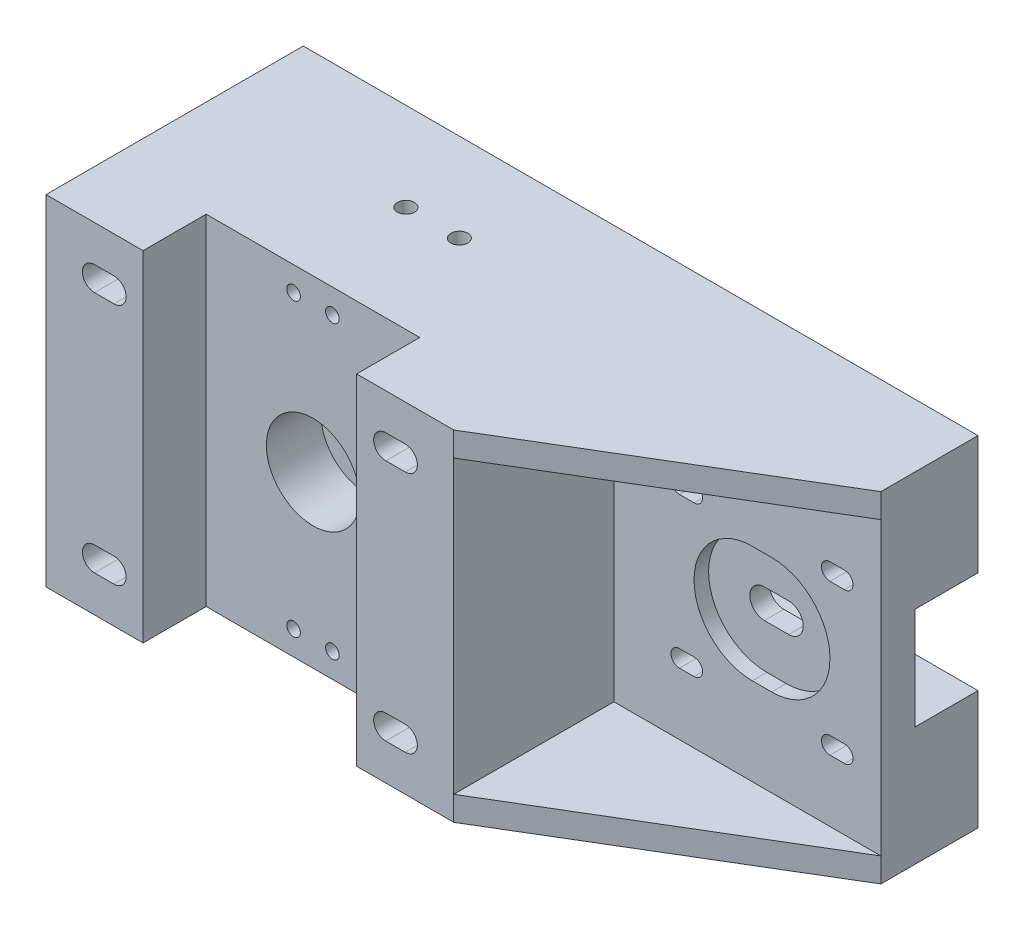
SolidWorks part; units mm, degrees
ref_plane "Спереди" through (0, 0, 0) normal (0, 0, 1) x (1, 0, 0)
ref_plane "Сверху" through (0, 0, 0) normal (0, 1, 0) x (1, 0, 0)
ref_plane "Справа" through (0, 0, 0) normal (1, 0, 0) x (0, 0, -1)
sketch "Эскиз1" plane through (0, 0, 0) normal (0, 1, 0) x (1, 0, 0)
  line L0 (0, 0) -> (0, 80) construction
  line L1 (-36.9154, 0) -> (36.9154, 0) construction
  line L2 (22, 0) -> (22, -13)
  line L3 (22, -13) -> (42, -13)
  line L4 (42, -13) -> (42, 40)
  line L5 (42, 40) -> (0, 40)
  line L6 (22, 0) -> (-22, 0)
  line L7 (-42, -13) -> (-42, 40)
  line L8 (-42, 40) -> (0, 40)
  line L9 (-22, -13) -> (-42, -13)
  line L10 (-22, 0) -> (-22, -13)
  dimension "D3" = 13
  dimension "D4" = 40
  dimension "D5" = 44
  dimension "D7" = 42
extrude "Бобышка-Вытянуть1" add sketch "Эскиз1" along normal blind 70
sketch "Эскиз2" plane through (0, 0, 0) normal (0, 0, 1) x (1, 0, 0)
  line L0 (0, 0) -> (0, 70) construction
  line L1 (22, 70) -> (-22, 70) construction
  line L2 (-22, 35) -> (0, 35) construction
  line L4 (-22, 70) -> (-22, 0) construction
  circle A0 centre (-4, 65) radius 1.4
  circle A1 centre (-4, 5) radius 1.4
  circle A2 centre (4, 5) radius 1.4
  circle A3 centre (4, 65) radius 1.4
  dimension "D1" = 5
  dimension "D2" = 4
  dimension "D3" = 2.8
extrude "Вырез-Вытянуть1" cut sketch "Эскиз2" against normal blind 5
sketch "Эскиз3" plane through (0, 0, 0) normal (0, 0, 1) x (1, 0, 0)
  line L0 (-22, 35) -> (22, 35) construction
  line L1 (-22, 70) -> (-22, 0) construction
  line L2 (22, 70) -> (22, 0) construction
  circle A0 centre (0, 35) radius 9.6
  dimension "D1" = 19.2
extrude "Вырез-Вытянуть2" cut sketch "Эскиз3" against normal blind 11.2
sketch "Эскиз4" plane through (0, 0, -40) normal (0, 0, -1) x (-1, 0, 0)
  line L0 (-42, 35) -> (42, 35) construction
  line L1 (-42, 70) -> (-42, 0) construction
  line L2 (42, 70) -> (42, 0) construction
  circle A0 centre (0, 35) radius 9.6
  dimension "D1" = 19.2
extrude "Вырез-Вытянуть3" cut sketch "Эскиз4" against normal blind 19
sketch "Эскиз5" plane through (42, 0, 0) normal (1, 0, 0) x (0, 0, -1)
  line L0 (-13, 35) -> (40, 35) construction
  line L1 (40, 70) -> (20, 70)
  line L2 (40, 70) -> (40, 0)
  line L3 (40, 0) -> (20, 0)
  line L4 (20, 70) -> (20, 0)
  line L5 (-13, 70) -> (-13, 0) construction
  line L6 (40, 70) -> (40, 0) construction
  line L7 (-13, 70) -> (40, 70) construction
  dimension "D2" = 20
extrude "Бобышка-Вытянуть2" add sketch "Эскиз5" along normal blind 55
sketch "Эскиз6" plane through (0, 0, -40) normal (0, 0, -1) x (-1, 0, 0)
  line L0 (0, 35) -> (-97, 35) construction
  line L1 (-97, 0) -> (-97, 70) construction
  line L2 (-97, 0) -> (-97, 70) construction
  line L3 (-97, 45.5) -> (10, 45.5)
  line L4 (-97, 45.5) -> (-97, 24.5)
  line L5 (-97, 24.5) -> (10, 24.5)
  line L6 (10, 45.5) -> (10, 24.5)
  circle A0 centre (0, 35) radius 9.6 construction
  dimension "D2" = 10
  dimension "D1" = 21
  dimension "D3" = 0
extrude "Вырез-Вытянуть4" cut sketch "Эскиз6" against normal blind 13
sketch "Эскиз7" plane through (0, 70, 0) normal (0, 1, 0) x (1, 0, 0)
  line L0 (42, -13) -> (97, 20)
  line L1 (97, 20) -> (42, 20)
  line L2 (42, 20) -> (42, -13)
extrude "Бобышка-Вытянуть3" add sketch "Эскиз7" against normal blind 5
sketch "Эскиз8" plane through (0, 0, 0) normal (0, -1, 0) x (1, 0, 0)
  line L0 (42, 13) -> (97, -20)
  line L1 (97, -20) -> (42, -20)
  line L2 (42, -20) -> (42, 13)
extrude "Бобышка-Вытянуть4" add sketch "Эскиз8" against normal blind 5
sketch "Эскиз9" plane through (0, 0, -40) normal (0, 0, -1) x (-1, 0, 0)
  line L0 (-89.5, 50.5) -> (-86.5, 50.5) construction
  line L1 (-89.5, 52.25) -> (-86.5, 52.25)
  line L2 (-89.5, 48.75) -> (-86.5, 48.75)
  line L3 (-58.5, 50.5) -> (-55.5, 50.5) construction
  line L4 (-58.5, 52.25) -> (-55.5, 52.25)
  line L5 (-58.5, 48.75) -> (-55.5, 48.75)
  line L6 (-89.5, 19.5) -> (-86.5, 19.5) construction
  line L7 (-89.5, 21.25) -> (-86.5, 21.25)
  line L8 (-89.5, 17.75) -> (-86.5, 17.75)
  line L9 (-58.5, 19.5) -> (-55.5, 19.5) construction
  line L10 (-58.5, 21.25) -> (-55.5, 21.25)
  line L11 (-58.5, 17.75) -> (-55.5, 17.75)
  arc A0 (-58.5, 21.25) -> (-58.5, 17.75) centre (-58.5, 19.5) ccw
  circle A1 centre (-57, 19.5) radius 2 construction
  circle A2 centre (-88, 19.5) radius 2 construction
  circle A3 centre (-88, 50.5) radius 2 construction
  circle A4 centre (-57, 50.5) radius 2 construction
  circle A6 centre (-57, 19.5) radius 2 construction
  circle A7 centre (-88, 19.5) radius 2 construction
  circle A8 centre (-88, 50.5) radius 2 construction
  circle A9 centre (-57, 50.5) radius 2 construction
  arc A14 (-89.5, 52.25) -> (-89.5, 48.75) centre (-89.5, 50.5) ccw
  arc A15 (-86.5, 48.75) -> (-86.5, 52.25) centre (-86.5, 50.5) ccw
  arc A16 (-58.5, 52.25) -> (-58.5, 48.75) centre (-58.5, 50.5) ccw
  arc A17 (-55.5, 48.75) -> (-55.5, 52.25) centre (-55.5, 50.5) ccw
  arc A18 (-89.5, 21.25) -> (-89.5, 17.75) centre (-89.5, 19.5) ccw
  arc A19 (-86.5, 17.75) -> (-86.5, 21.25) centre (-86.5, 19.5) ccw
  arc A20 (-55.5, 17.75) -> (-55.5, 21.25) centre (-55.5, 19.5) ccw
  point P10 (-88, 50.5)
  point P19 (-57, 50.5)
  point P26 (-88, 19.5)
  point P33 (-57, 19.5)
  dimension "D1" = 3.5
  dimension "D2" = 3
  dimension "D3" = 3.5
  dimension "D4" = 3
  dimension "D5" = 3.5
  dimension "D6" = 3
  dimension "D7" = 3
  dimension "D8" = 3.5
extrude "Вырез-Вытянуть5" cut sketch "Эскиз9" against normal blind 68
sketch "Эскиз10" plane through (0, 0, -21) normal (0, 0, -1) x (-1, 0, 0)
  circle A0 centre (0, 35) radius 3.25
  dimension "D1" = 6.5
extrude "Вырез-Вытянуть6" cut sketch "Эскиз10" against normal blind 68
sketch "Эскиз11" plane through (0, 0, -20) normal (0, 0, 1) x (1, 0, 0)
  line L0 (70.5, 35) -> (74.5, 35) construction
  line L1 (70.5, 47) -> (74.5, 47)
  line L2 (70.5, 23) -> (74.5, 23)
  circle A0 centre (72.5, 35) radius 11 construction
  circle A1 centre (72.5, 35) radius 11 construction
  arc A3 (70.5, 47) -> (70.5, 23) centre (70.5, 35) ccw
  arc A4 (74.5, 23) -> (74.5, 47) centre (74.5, 35) ccw
  point P5 (72.5, 35)
  dimension "D1" = 24
  dimension "D2" = 4
extrude "Вырез-Вытянуть7" cut sketch "Эскиз11" against normal blind 3
sketch "Эскиз12" plane through (0, 0, -23) normal (0, 0, 1) x (1, 0, 0)
  line L0 (72.5, 47) -> (72.5, 23) construction
  line L1 (74.5, 47) -> (70.5, 47) construction
  line L2 (70.5, 23) -> (74.5, 23) construction
  line L3 (70, 35) -> (75, 35) construction
  line L4 (70, 38) -> (75, 38)
  line L5 (70, 32) -> (75, 32)
  arc A1 (70, 38) -> (70, 32) centre (70, 35) ccw
  arc A2 (75, 32) -> (75, 38) centre (75, 35) ccw
  point P9 (72.5, 35)
  dimension "D1" = 6
  dimension "D2" = 5
extrude "Вырез-Вытянуть8" cut sketch "Эскиз12" against normal through all
sketch "Эскиз14" plane through (0, 0, -40) normal (0, 0, -1) x (-1, 0, 0)
  line L0 (-91.25, 50.5) -> (-84.75, 50.5) construction
  line L1 (-88, 52.25) -> (-88, 48.75) construction
  line L2 (-86.5, 52.25) -> (-89.5, 52.25) construction
  line L3 (-89.5, 48.75) -> (-86.5, 48.75) construction
  line L4 (-60.25, 50.5) -> (-53.75, 50.5) construction
  line L5 (-57, 52.25) -> (-57, 48.75) construction
  line L6 (-55.5, 52.25) -> (-58.5, 52.25) construction
  line L7 (-58.5, 48.75) -> (-55.5, 48.75) construction
  line L8 (-88, 21.25) -> (-88, 17.75) construction
  line L9 (-86.5, 21.25) -> (-89.5, 21.25) construction
  line L10 (-89.5, 17.75) -> (-86.5, 17.75) construction
  line L11 (-91.25, 19.5) -> (-84.75, 19.5) construction
  line L12 (-57, 21.25) -> (-57, 17.75) construction
  line L13 (-55.5, 21.25) -> (-58.5, 21.25) construction
  line L14 (-58.5, 17.75) -> (-55.5, 17.75) construction
  line L15 (-60.25, 19.5) -> (-53.75, 19.5) construction
  line L16 (-90, 50.5) -> (-86, 50.5) construction
  line L17 (-90, 53.5) -> (-86, 53.5)
  line L18 (-90, 47.5) -> (-86, 47.5)
  line L19 (-59, 50.5) -> (-55, 50.5) construction
  line L20 (-59, 53.5) -> (-55, 53.5)
  line L21 (-59, 47.5) -> (-55, 47.5)
  line L22 (-90, 19.5) -> (-86, 19.5) construction
  line L23 (-90, 22.5) -> (-86, 22.5)
  line L24 (-90, 16.5) -> (-86, 16.5)
  line L25 (-59, 19.5) -> (-55, 19.5) construction
  line L26 (-59, 22.5) -> (-55, 22.5)
  line L27 (-59, 16.5) -> (-55, 16.5)
  arc A0 (-89.5, 52.25) -> (-89.5, 48.75) centre (-89.5, 50.5) ccw construction
  arc A1 (-86.5, 48.75) -> (-86.5, 52.25) centre (-86.5, 50.5) ccw construction
  arc A2 (-58.5, 52.25) -> (-58.5, 48.75) centre (-58.5, 50.5) ccw construction
  arc A3 (-55.5, 48.75) -> (-55.5, 52.25) centre (-55.5, 50.5) ccw construction
  arc A4 (-89.5, 21.25) -> (-89.5, 17.75) centre (-89.5, 19.5) ccw construction
  arc A5 (-86.5, 17.75) -> (-86.5, 21.25) centre (-86.5, 19.5) ccw construction
  arc A6 (-58.5, 21.25) -> (-58.5, 17.75) centre (-58.5, 19.5) ccw construction
  arc A7 (-55.5, 17.75) -> (-55.5, 21.25) centre (-55.5, 19.5) ccw construction
  arc A8 (-90, 53.5) -> (-90, 47.5) centre (-90, 50.5) ccw
  arc A9 (-86, 47.5) -> (-86, 53.5) centre (-86, 50.5) ccw
  arc A10 (-59, 53.5) -> (-59, 47.5) centre (-59, 50.5) ccw
  arc A11 (-55, 47.5) -> (-55, 53.5) centre (-55, 50.5) ccw
  arc A12 (-90, 22.5) -> (-90, 16.5) centre (-90, 19.5) ccw
  arc A13 (-86, 16.5) -> (-86, 22.5) centre (-86, 19.5) ccw
  arc A14 (-59, 22.5) -> (-59, 16.5) centre (-59, 19.5) ccw
  arc A15 (-55, 16.5) -> (-55, 22.5) centre (-55, 19.5) ccw
  point P58 (-88, 50.5)
  point P63 (-57, 50.5)
  point P72 (-88, 19.5)
  point P77 (-57, 19.5)
  dimension "D1" = 6
  dimension "D2" = 6
  dimension "D3" = 6
  dimension "D4" = 6
  dimension "D5" = 4
  dimension "D6" = 4
  dimension "D7" = 4
  dimension "D8" = 4
extrude "Вырез-Вытянуть10" cut sketch "Эскиз14" against normal blind 5
sketch "Эскиз15" plane through (0, 0, -40) normal (0, 0, -1) x (-1, 0, 0)
  line L0 (42, 35) -> (-97, 35) construction
  line L1 (42, 70) -> (42, 0) construction
  line L2 (-97, 45.5) -> (-97, 24.5) construction
  line L3 (-97, 70) -> (42, 70) construction
  line L4 (-92, 65) -> (37, 65) construction
  line L5 (-92, 65) -> (-92, 5) construction
  line L6 (-92, 5) -> (37, 5) construction
  line L7 (37, 65) -> (37, 5) construction
  line L8 (-97, 45.5) -> (-97, 70) construction
  line L9 (-13, 65) -> (-13, 5) construction
  circle A0 centre (-92, 65) radius 1.4
  circle A1 centre (37, 65) radius 1.4
  circle A2 centre (37, 5) radius 1.4
  circle A3 centre (-92, 5) radius 1.4
  circle A4 centre (-13, 65) radius 1.4
  circle A6 centre (-13, 5) radius 1.4
  dimension "D4" = 2.8
  dimension "D1" = 5
  dimension "D2" = 5
  dimension "D3" = 5
  dimension "D5" = 50
extrude "Вырез-Вытянуть11" cut sketch "Эскиз15" against normal blind 5
ref_plane "Плоскость1" through (0, 35, 0) normal (0, -1, 0) x (-1, 0, 0)
sketch "Эскиз16" plane through (0, 0, 13) normal (0, 0, 1) x (1, 0, 0)
  line L0 (-42, 35) -> (42, 35) construction
  line L1 (-42, 70) -> (-42, 0) construction
  line L2 (42, 65) -> (42, 5) construction
  line L4 (-30, 10) -> (30, 10) construction
  line L5 (-30, 10) -> (-30, 60) construction
  line L6 (-30, 60) -> (30, 60) construction
  line L7 (30, 10) -> (30, 60) construction
  line L8 (-30, 10) -> (30, 60) construction
  line L9 (-30, 60) -> (30, 10) construction
  circle A0 centre (-30, 60) radius 2.4
  circle A1 centre (30, 60) radius 2.4
  circle A2 centre (30, 10) radius 2.4
  circle A3 centre (-30, 10) radius 2.4
  point P6 (0, 35)
  dimension "D1" = 4.8
  dimension "D2" = 50
  dimension "D3" = 60
extrude "Вырез-Вытянуть12" cut sketch "Эскиз16" against normal through all
sketch "Эскиз17" plane through (0, 70, 0) normal (0, 1, 0) x (1, 0, 0)
  circle A0 centre (8.35, 21.8) radius 1.75 construction
  circle A1 centre (-2.65, 21.8) radius 1.75 construction
  circle A2 centre (8.35, 21.8) radius 1.75
  circle A3 centre (-2.65, 21.8) radius 1.75
extrude "Вырез-Вытянуть13" cut sketch "Эскиз17" against normal blind 10
sketch "Эскиз18" plane through (0, 0, -40) normal (0, 0, -1) x (-1, 0, 0)
  line L0 (-33, 60) -> (-27, 60) construction
  line L1 (-33, 64) -> (-27, 64)
  line L2 (-33, 56) -> (-27, 56)
  line L3 (27, 60) -> (33, 60) construction
  line L4 (27, 64) -> (33, 64)
  line L5 (27, 56) -> (33, 56)
  line L6 (0, 35) -> (35.0885, 35) construction
  line L7 (27, 10) -> (33, 10) construction
  line L8 (27, 6) -> (33, 6)
  line L9 (27, 14) -> (33, 14)
  line L10 (-33, 10) -> (-27, 10) construction
  line L11 (-33, 6) -> (-27, 6)
  line L12 (-33, 14) -> (-27, 14)
  arc A0 (-33, 64) -> (-33, 56) centre (-33, 60) ccw
  arc A1 (-27, 56) -> (-27, 64) centre (-27, 60) ccw
  arc A2 (27, 64) -> (27, 56) centre (27, 60) ccw
  arc A3 (33, 56) -> (33, 64) centre (33, 60) ccw
  arc A4 (27, 6) -> (27, 14) centre (27, 10) cw
  arc A5 (33, 14) -> (33, 6) centre (33, 10) cw
  arc A6 (-33, 6) -> (-33, 14) centre (-33, 10) cw
  arc A7 (-27, 14) -> (-27, 6) centre (-27, 10) cw
  point P2 (-30, 60)
  point P7 (30, 60)
  point P10 (-30, 56)
  point P22 (30, 10)
  point P29 (-30, 10)
  dimension "D1" = 6
  dimension "D2" = 8
  dimension "D3" = 8
extrude "Вырез-Вытянуть14" cut sketch "Эскиз18" against normal blind 25
sketch "Эскиз19" plane through (0, 0, 13) normal (0, 0, 1) x (1, 0, 0)
  line L0 (-32, 60) -> (-28, 60) construction
  line L1 (-32, 62.5) -> (-28, 62.5)
  line L2 (-32, 57.5) -> (-28, 57.5)
  line L3 (28, 60) -> (32, 60) construction
  line L4 (28, 62.5) -> (32, 62.5)
  line L5 (28, 57.5) -> (32, 57.5)
  line L6 (0, 35) -> (33.0216, 35) construction
  line L7 (28, 10) -> (32, 10) construction
  line L8 (28, 7.5) -> (32, 7.5)
  line L9 (28, 12.5) -> (32, 12.5)
  line L10 (-32, 10) -> (-28, 10) construction
  line L11 (-32, 7.5) -> (-28, 7.5)
  line L12 (-32, 12.5) -> (-28, 12.5)
  arc A0 (-32, 62.5) -> (-32, 57.5) centre (-32, 60) ccw
  arc A1 (-28, 57.5) -> (-28, 62.5) centre (-28, 60) ccw
  arc A2 (28, 62.5) -> (28, 57.5) centre (28, 60) ccw
  arc A3 (32, 57.5) -> (32, 62.5) centre (32, 60) ccw
  arc A4 (28, 7.5) -> (28, 12.5) centre (28, 10) cw
  arc A5 (32, 12.5) -> (32, 7.5) centre (32, 10) cw
  arc A6 (-32, 7.5) -> (-32, 12.5) centre (-32, 10) cw
  arc A7 (-28, 12.5) -> (-28, 7.5) centre (-28, 10) cw
  point P2 (-30, 60)
  point P7 (30, 60)
  point P21 (30, 10)
  point P28 (-30, 10)
  dimension "D1" = 5
  dimension "D2" = 4
  dimension "D3" = 4
  dimension "D4" = 5
extrude "Вырез-Вытянуть15" cut sketch "Эскиз19" against normal through all
